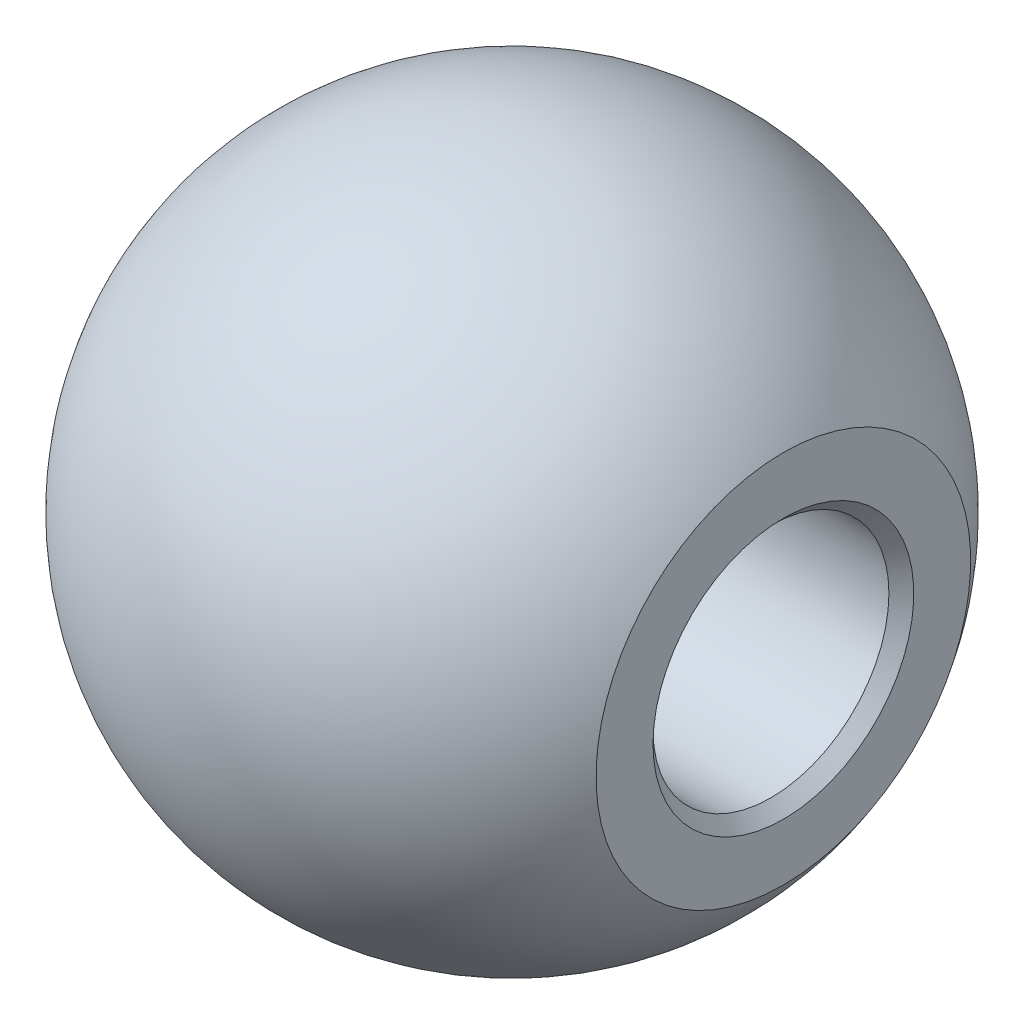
SolidWorks part; units mm, degrees
ref_plane "Front Plane" through (0, 0, 0) normal (0, 0, 1) x (1, 0, 0)
ref_plane "Top Plane" through (0, 0, 0) normal (0, 1, 0) x (1, 0, 0)
ref_plane "Right Plane" through (0, 0, 0) normal (1, 0, 0) x (0, 0, -1)
sketch "Sketch1" plane through (0, 0, 0) normal (0, 0, 1) x (1, 0, 0)
  line L0 (-6.8851, 0) -> (-3.8904, 0) construction
  line L1 (-5.5499, 3.8309) -> (-5.5499, 2.413)
  line L2 (-5.5499, 2.413) -> (5.5499, 2.413)
  line L3 (5.5499, 2.413) -> (5.5499, 3.8309)
  arc A0 (5.5499, 3.8309) -> (-5.5499, 3.8309) centre (0, 0) ccw
  dimension "Ball_Dia" = 13.4874
  dimension "B" = 4.826
  dimension "W" = 11.0998
revolve "Revolve1" add sketch "Sketch1" angle 360 about L0
chamfer "Chamfer1" distance 0.254 angle 45 2 edges at (-5.5499, 0, 2.413) (5.5499, 0, 2.413)
